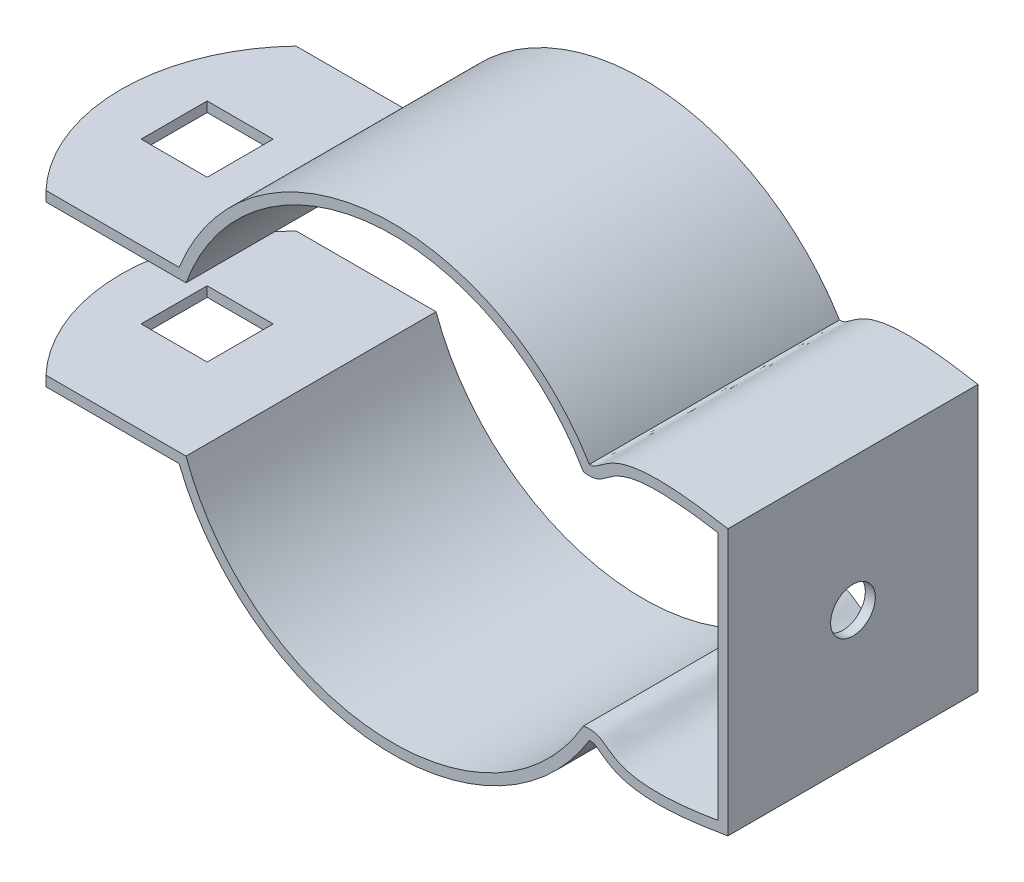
SolidWorks part; units mm, degrees
ref_plane "Front" through (0, 0, 0) normal (0, 0, 1) x (1, 0, 0)
ref_plane "Top" through (0, 0, 0) normal (0, 1, 0) x (1, 0, 0)
ref_plane "Right" through (0, 0, 0) normal (1, 0, 0) x (0, 0, -1)
sketch "Sketch1" plane through (0, 0, 0) normal (0, 0, 1) x (1, 0, 0)
  line L0 (2.5097, 0) -> (-11.4903, 0) construction
  line L1 (-20.6821, 7.5) -> (-34.6821, 7.5)
  line L2 (-20.6821, -7.5) -> (-34.6821, -7.5)
  line L3 (32.5, 12.453) -> (32.5, -12.453)
  line L4 (-21.3717, -8.5) -> (-34.6821, -8.5)
  line L5 (33.5, 13.298) -> (33.5, -13.298)
  line L6 (-21.3717, 8.5) -> (-34.6821, 8.5)
  line L7 (2.5097, 1) -> (-11.4903, 1)
  line L8 (-34.6821, 7.5) -> (-34.6821, 8.5)
  line L9 (-34.6821, -7.5) -> (-34.6821, -8.5)
  arc A0 (19.0526, 11) -> (-20.6821, 7.5) centre (0, 0) ccw
  arc A1 (-20.6821, -7.5) -> (19.0526, -11) centre (0, 0) ccw
  arc A2 (-21.3717, -8.5) -> (19.6509, -11.9516) centre (0, 0) ccw
  arc A3 (19.6509, 11.9516) -> (-21.3717, 8.5) centre (0, 0) ccw
  spline S0 degree 3 poles (19.0526, 11) (22.5443, 10.4664) (20.0291, 14.5626) (32.5, 12.453) knots 0 0 0 0 0.859078 0.859078 0.859078 0.859078
  spline S1 degree 3 poles (19.0526, -11) (22.5443, -10.4664) (20.0291, -14.5626) (32.5, -12.453) knots 0 0 0 0 0.859078 0.859078 0.859078 0.859078
  spline S2 degree 1 poles (19.6509, -11.9516) (33.5, -13.298) knots 0 0 1 1 construction
  spline S3 degree 1 poles (19.6509, 11.9516) (33.5, 13.298) knots 0 0 1 1 construction
  spline S4 degree 3 poles (19.6509, -11.9516) (19.7429, -11.9521) (19.9477, -11.9718) (20.1233, -12.029) (20.3194, -12.126) (20.6465, -12.3461) (21.231, -12.8093) (22.3293, -13.4446) (23.9159, -13.9155) (25.7592, -14.0846) (27.6553, -14.0454) (29.3191, -13.9163) (30.9256, -13.7163) (32.3696, -13.4917) (33.1261, -13.3613) (33.5, -13.298) knots 0.055208 0.055208 0.055208 0.055208 0.106646 0.158084 0.209521 0.260959 0.363834 0.466709 0.569585 0.67246 0.723898 0.775335 0.826773 0.852492 0.87821 0.87821 0.87821 0.87821
  spline S5 degree 3 poles (33.5, 13.298) (33.1261, 13.3613) (32.3696, 13.4917) (30.9256, 13.7163) (29.3191, 13.9163) (27.6553, 14.0454) (25.7592, 14.0846) (23.9159, 13.9155) (22.3293, 13.4446) (21.231, 12.8093) (20.6465, 12.3461) (20.3194, 12.126) (20.1233, 12.029) (19.9477, 11.9718) (19.7429, 11.9521) (19.6509, 11.9516) knots 0.055208 0.055208 0.055208 0.055208 0.080927 0.106646 0.158084 0.209521 0.260959 0.363834 0.466709 0.569585 0.67246 0.723898 0.775335 0.826773 0.87821 0.87821 0.87821 0.87821
  point P14 (32.5, 0)
  dimension "D1" = 44
  dimension "D7" = 1
  dimension "D2" = 15
  dimension "D3" = 14
  dimension "D5" = 12.453
extrude "Boss-Extrude1" add sketch "Sketch1" along normal blind 25 contours L5 S5 A3 L6 L8 L1 A0 S0 L3 S1 A1 L2 L9 L4 A2 S4
sketch "Sketch2" plane through (0, -8.5, 0) normal (0, -1, 0) x (1, 0, 0)
  line L0 (-34.6821, 25) -> (-34.6821, 0) construction
  line L1 (-34.6821, 12.5) -> (-39.6821, 12.5) construction
  line L2 (-34.6821, 25) -> (-34.6821, -6.358) construction
  line L3 (-34.6821, 25) -> (-34.6821, 0)
  arc A0 (-34.6821, 25) -> (-34.6821, 0) centre (-21.5571, 12.5) ccw
  dimension "D1" = 5
extrude "Boss-Extrude2" add sketch "Sketch2" against normal up to surface (16 mm away) contours A0 L3
mirror "Mirror1" about plane through (0, 0, 0) normal (0, 1, 0) of "Boss-Extrude2"
sketch "Sketch3" plane through (-34.6821, 0, 0) normal (1, 0, 0) x (0, 0, -1)
  line L1 (-25, 7.5) -> (0, 7.5)
  line L2 (-25, 7.5) -> (-25, -7.5)
  line L3 (-25, -7.5) -> (0, -7.5)
  line L4 (0, 7.5) -> (0, -7.5)
extrude "Cut-Extrude1" cut sketch "Sketch3" against normal blind 25
sketch "Sketch4" plane through (0, -8.5, 0) normal (0, -1, 0) x (1, 0, 0)
  line L1 (-34.3717, 15.802) -> (-27.7677, 15.802)
  line L2 (-34.3717, 15.802) -> (-34.3717, 9.198)
  line L3 (-34.3717, 9.198) -> (-27.7677, 9.198)
  line L4 (-27.7677, 15.802) -> (-27.7677, 9.198)
  line L5 (-21.3717, 25) -> (-21.3717, 0) construction
  line L9 (-24.1943, 0) -> (-24.1943, 25) construction
  line L10 (-21.3717, 0) -> (-34.6821, 0) construction
  line L11 (-21.3717, 25) -> (-34.6821, 25) construction
  point P12 (-24.1943, 12.5)
  point P13 (-27.7677, 12.5)
  dimension "D1" = 6.604
  dimension "D2" = 13
  dimension "D3" = 6.604
extrude "Cut-Extrude2" cut sketch "Sketch4" against normal blind 25
sketch "Sketch6" plane through (33.5, 0, 0) normal (1, 0, 0) x (0, 0, -1)
  line L2 (-25, 0) -> (0, 0) construction
  line L3 (-25, 13.298) -> (-25, -13.298) construction
  line L4 (-12.5, 13.298) -> (-12.5, -13.298) construction
  line L5 (-25, 13.298) -> (0, 13.298) construction
  line L6 (-25, -13.298) -> (0, -13.298) construction
  circle A0 centre (-12.5, 0) radius 2.2339
  dimension "D1" = 4.4679
extrude "Cut-Extrude3" cut sketch "Sketch6" against normal blind 25
